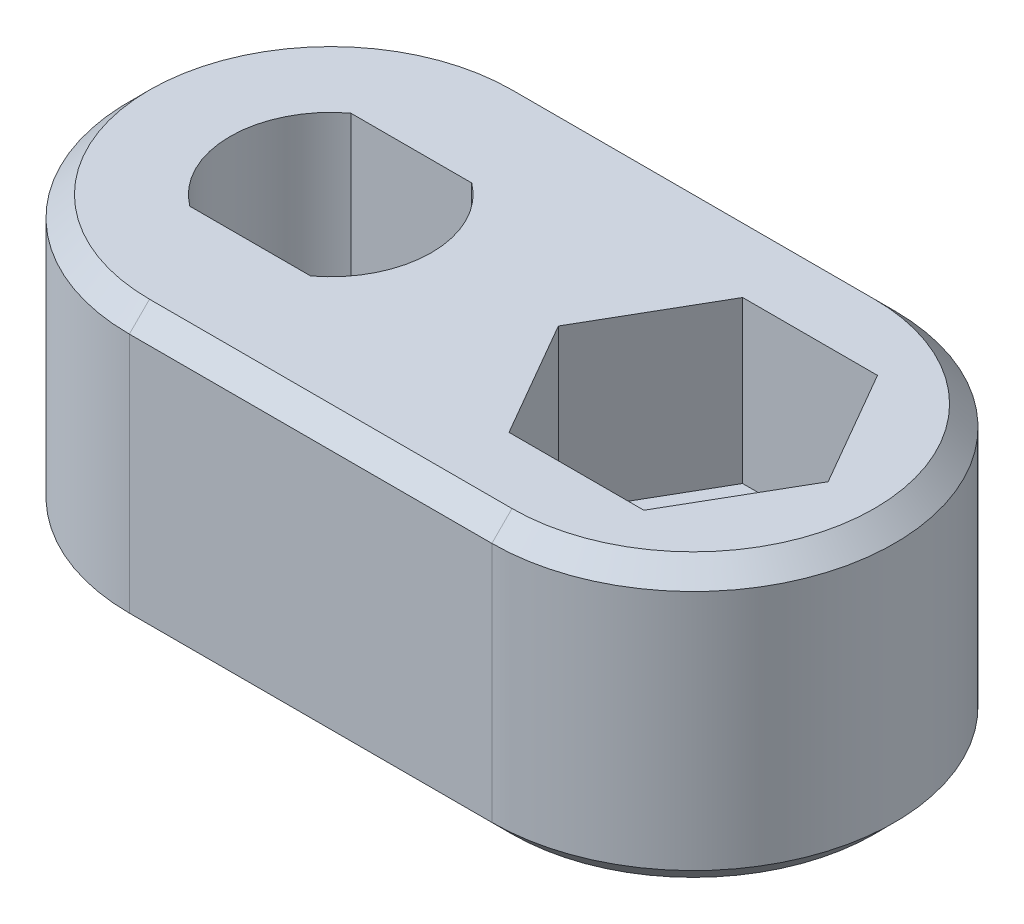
SolidWorks part; units mm, degrees
ref_plane "前视基准面" through (0, 0, 0) normal (0, 0, 1) x (1, 0, 0)
ref_plane "上视基准面" through (0, 0, 0) normal (0, 1, 0) x (1, 0, 0)
ref_plane "右视基准面" through (0, 0, 0) normal (1, 0, 0) x (0, 0, -1)
sketch "草图1" plane through (0, 0, 0) normal (0, 1, 0) x (1, 0, 0)
  line L0 (0, 0) -> (9, 0) construction
  line L1 (0, 5) -> (9, 5)
  line L2 (0, -5) -> (9, -5)
  arc A0 (0, 5) -> (0, -5) centre (0, 0) ccw
  arc A1 (9, -5) -> (9, 5) centre (9, 0) ccw
  point P3 (4.5, 0)
  dimension "D1" = 10
  dimension "D2" = 9
extrude "凸台-拉伸1" add sketch "草图1" along normal blind 7
sketch "草图2" plane through (0, 7, 0) normal (0, 1, 0) x (1, 0, 0)
  line L0 (-1.5, -2) -> (1.5, -2)
  line L1 (-1.5, 2) -> (1.5, 2)
  line L2 (0, 0) -> (3.4959, 0) construction
  circle A0 centre (0, 0) radius 2.5
  dimension "D1" = 5
  dimension "D2" = 4
extrude "切除-拉伸1" cut sketch "草图2" against normal blind 4
hole_wizard "M3 六角凹锥坑螺钉的锥形沉头孔1" positions "草图3" profile "草图4" countersink size "M3" standard "ISO"
sketch "草图3" plane through (0, 0, 0) normal (0, -1, 0) x (-1, 0, 0)
  point P0 (0, 0)
sketch "草图4" plane through (0, 0, 0) normal (1, 0, 0) x (0, 0, -1)
  line L0 (0, 0) -> (0, 8.5215)
  line L1 (0, 8.5215) -> (1.7, 7.5)
  line L2 (1.7, 7.5) -> (1.7, 1.66)
  line L3 (1.7, 1.66) -> (3.36, 0)
  line L5 (3.36, 0) -> (0, 0)
  line L6 (-1.7, 1.66) -> (-3.36, 0) construction
  line L10 (0, 8.5215) -> (-1.7, 7.5) construction
  line L11 (0, -6.35) -> (0, 107.95) construction
  dimension "孔直径" = 3.4
  dimension "孔深度" = 7.5
  dimension "近端锥形沉头孔直径" = 6.72
  dimension "近端锥形沉头孔角度" = 90
  dimension "导头角度" = 118
hole_wizard "孔1" positions "草图5" profile "草图6" legacy
sketch "草图5" plane through (0, 0, 0) normal (0, -1, 0) x (-1, 0, 0)
  point P0 (-9, 0)
sketch "草图6" plane through (9, 0, 0) normal (1, 0, 0) x (0, 0, -1)
  line L0 (0, 0) -> (0, 7)
  line L1 (0, 7) -> (2.075, 7)
  line L2 (2.075, 7) -> (2.075, 0)
  line L3 (2.075, 0) -> (0, 0)
  line L4 (0, 110) -> (0, -10) construction
  dimension "直径" = 4.15
  dimension "深度" = 7
sketch "草图7" plane through (0, 7, 0) normal (0, 1, 0) x (1, 0, 0)
  line L0 (9, 5) -> (0, 5) construction
  line L1 (12.3486, 0) -> (10.6743, 2.9)
  line L2 (10.6743, 2.9) -> (7.3257, 2.9)
  line L3 (7.3257, 2.9) -> (5.6514, 0)
  line L4 (5.6514, 0) -> (7.3257, -2.9)
  line L5 (7.3257, -2.9) -> (10.6743, -2.9)
  line L6 (10.6743, -2.9) -> (12.3486, 0)
  circle A0 centre (9, 0) radius 2.9 construction
  dimension "D1" = 5.8
extrude "切除-拉伸2" cut sketch "草图7" against normal blind 4
chamfer "倒角1" distance 0.5 angle 45 8 edges at (4.5, 7, -5) (-5, 7, 0) (14, 7, 0) (4.5, 7, 5) (4.5, 0, -5) (-5, 0, 0) (14, 0, 0) (4.5, 0, 5)
